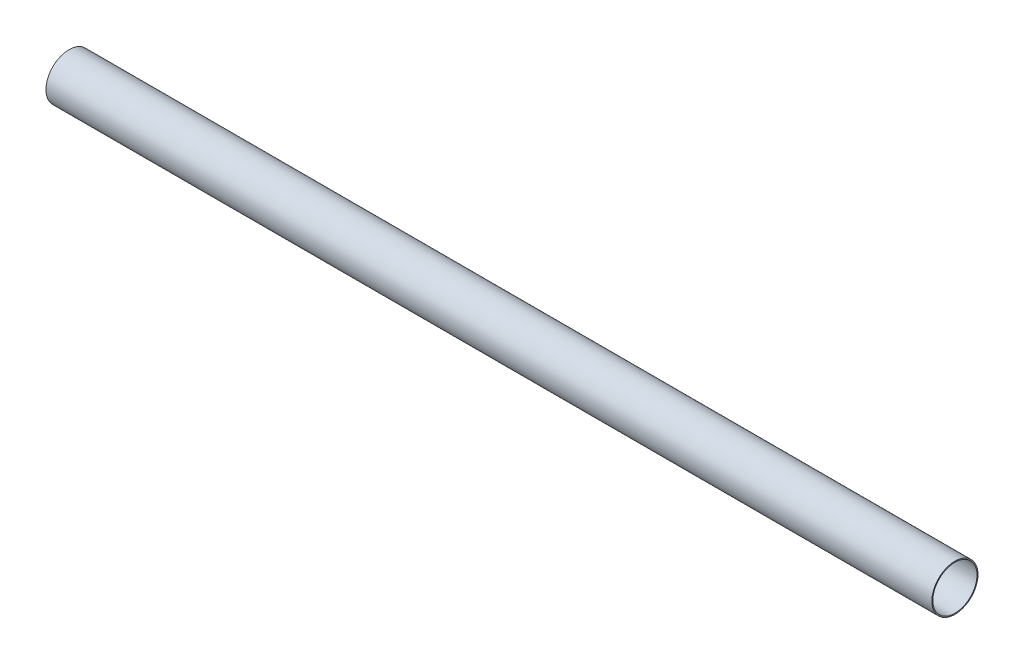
SolidWorks part; units mm, degrees
ref_plane "Piano frontale" through (0, 0, 0) normal (0, 0, 1) x (1, 0, 0)
ref_plane "Piano superiore" through (0, 0, 0) normal (0, 1, 0) x (1, 0, 0)
ref_plane "Piano destro" through (0, 0, 0) normal (1, 0, 0) x (0, 0, -1)
sketch "Sketch1" plane through (0, 0, 0) normal (1, 0, 0) x (0, 0, -1)
  circle A0 centre (0, 0) radius 45
  circle A1 centre (0, 0) radius 43
extrude "Boss-Extrude1" add sketch "Sketch1" against normal blind 1728
